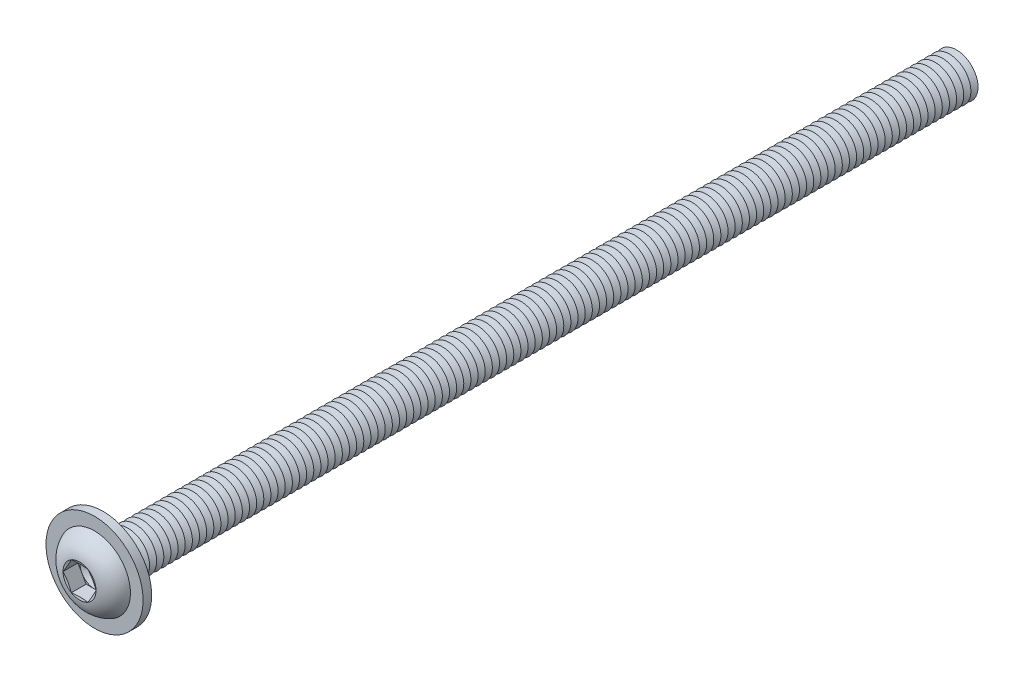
SolidWorks part; units mm, degrees
ref_plane "Front Plane" through (0, 0, 0) normal (0, 0, 1) x (1, 0, 0)
ref_plane "Top Plane" through (0, 0, 0) normal (0, 1, 0) x (1, 0, 0)
ref_plane "Right Plane" through (0, 0, 0) normal (1, 0, 0) x (0, 0, -1)
sketch "Sketch1" plane through (0, 0, 0) normal (1, 0, 0) x (0, 0, -1)
  line L0 (0, 3) -> (0, 5.25)
  line L3 (0, 3) -> (120, 3)
  line L4 (120, 3) -> (120, 0)
  line L5 (120, 0) -> (-3.3, 0) construction
  line L6 (-3.3, 0) -> (120, 0)
  line L7 (-3.3, 2.3094) -> (-3.3, 1.1547) construction
  line L8 (-3.3, 1.1547) -> (-3.3, 0)
  line L9 (-3.3, 2.3094) -> (-2.9906, 1.1547)
  line L10 (-2.9906, 1.1547) -> (-3.3, 1.1547)
  line L11 (120, 0) -> (22.7481, 0) construction
  line L12 (0, 5.25) -> (-3.3, 5.25) construction
  arc A1 (0, 5.25) -> (-3.3, 2.3094) centre (0, 1.928) ccw
  point P8 (120, 1.5)
  dimension "D1" = 10.5
  dimension "D2" = 6
  dimension "D3" = 3.3
  dimension "D4" = 4.6188
  dimension "D5" = 120
  dimension "D6" = 15
revolve "Revolve1" add sketch "Sketch1" angle 360 about L5
fillet "Fillet1" radius 0.5 1 edges at (0, 3, 0)
sketch "Sketch2" plane through (0, 0, 0) normal (1, 0, 0) x (0, 0, -1)
  line L0 (119.5, 3) -> (120.5, 3)
  line L1 (120, 3) -> (0.5, 3) construction
  line L2 (120.5, 3) -> (120, 2.134)
  line L3 (120, -3) -> (120, 3) construction
  line L4 (120, 2.134) -> (119.5, 3)
  dimension "D1" = 1
revolve "Cut-Revolve1" cut sketch "Sketch2" angle 360 about axis through (0, 0, -120) along (0, 0, -1)
pattern_linear "LPattern1" count 120 spacing 1 along (0, 0, 1) of "Cut-Revolve1"
sketch "Sketch3" plane through (0, 0, 3.3) normal (0, 0, 1) x (1, 0, 0)
  line L7 (1.1547, 2) -> (-1.1547, 2)
  line L8 (-1.1547, 2) -> (-2.3094, 0)
  line L9 (-2.3094, 0) -> (-1.1547, -2)
  line L10 (-1.1547, -2) -> (1.1547, -2)
  line L11 (1.1547, -2) -> (2.3094, 0)
  line L12 (2.3094, 0) -> (1.1547, 2)
  circle A0 centre (0, 0) radius 2 construction
  circle A3 centre (0, 0) radius 2.3094 construction
extrude "Cut-Extrude1" cut sketch "Sketch3" against normal blind 2.08
sketch "Sketch4" plane through (0, 0, 1.22) normal (0, 0, 1) x (1, 0, 0)
  line L1 (1.1547, 2) -> (-1.1547, 2) construction
  circle A0 centre (0, 0) radius 2
extrude "Cut-Extrude2" cut sketch "Sketch4" against normal through all draft 60
sketch "Sketch5" plane through (0, 0, 0) normal (0, 0, -1) x (-1, 0, 0)
  circle A0 centre (0, 0) radius 6.8
  circle A1 centre (0, 0) radius 3.5
  circle A2 centre (0, 0) radius 3.5 construction
  dimension "D1" = 13.6
extrude "Boss-Extrude1" add sketch "Sketch5" against normal blind 1.2
